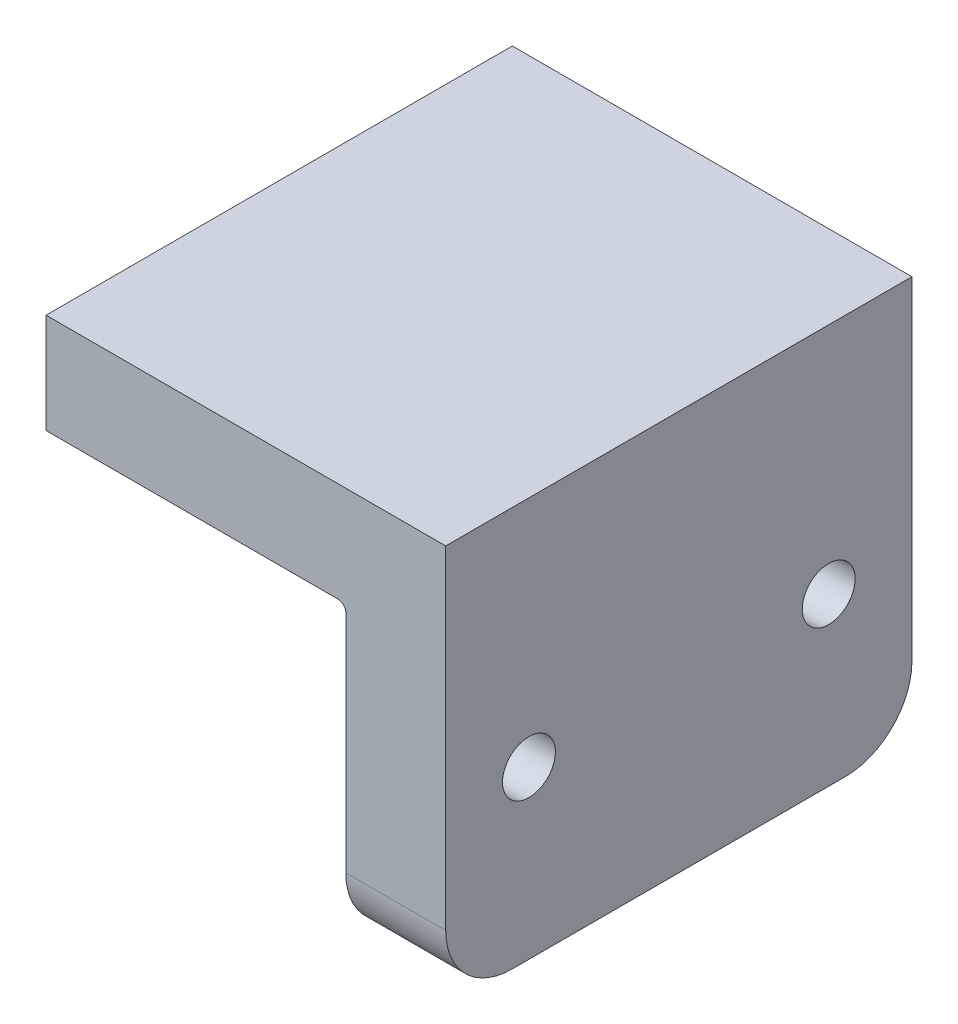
SolidWorks part; units mm, degrees
ref_plane "Front Plane" through (0, 0, 0) normal (0, 0, 1) x (1, 0, 0)
ref_plane "Top Plane" through (0, 0, 0) normal (0, 1, 0) x (1, 0, 0)
ref_plane "Right Plane" through (0, 0, 0) normal (1, 0, 0) x (0, 0, -1)
sketch "Sketch1" plane through (0, 0, 0) normal (0, 0, 1) x (1, 0, 0)
  line L2 (-76.2, 0) -> (-76.2, -19.05)
  line L3 (-76.2, -19.05) -> (-19.05, -19.05)
  line L5 (0, 0) -> (-76.2, 0)
  line L6 (0, 0) -> (0, -76.2)
  line L7 (0, -76.2) -> (-19.05, -76.2)
  line L8 (-19.05, -19.05) -> (-19.05, -76.2)
  dimension "D1" = 76.2
  dimension "D2" = 76.2
  dimension "D3" = 19.05
extrude "Extrude1" add sketch "Sketch1" along normal mid plane 88.9
fillet "Fillet1" radius 1.524 1 edges at (-19.05, -19.05, 0)
hole_wizard "CBORE for 3/8 Socket Head Cap Screw1" positions "Sketch3" profile "Sketch2" counterbore size "3/8" standard "Ansi Inch"
sketch "Sketch3" plane through (-19.05, 0, 0) normal (-1, 0, 0) x (0, 0, 1)
  line L0 (0, -76.2) -> (0, -38.9537) construction
  line L1 (44.45, -76.2) -> (-44.45, -76.2) construction
  line L2 (-44.45, -20.574) -> (-44.45, -76.2) construction
  point P0 (-28.575, -44.45)
  point P8 (28.575, -44.45)
  dimension "D1" = 15.875
  dimension "D2" = 31.75
sketch "Sketch2" plane through (-19.05, -44.45, -28.575) normal (0, 1, 0) x (0, 0, 1)
  line L0 (0, 0) -> (0, 19.05)
  line L1 (0, 19.05) -> (5.0419, 19.05)
  line L3 (5.0419, 19.05) -> (5.0419, 9.525)
  line L4 (5.0419, 9.525) -> (7.9375, 9.525)
  line L5 (7.9375, 9.525) -> (7.9375, 0)
  line L7 (7.9375, 0) -> (0, 0)
  line L11 (0, -6.35) -> (0, 107.95) construction
  dimension "Thru Hole Dia." = 10.0838
  dimension "Thru Hole Depth" = 19.05
  dimension "C'Bore Dia." = 15.875
  dimension "C'Bore Depth" = 9.525
fillet "Fillet2" radius 12.7 2 edges at (-9.525, -76.2, -44.45) (-9.525, -76.2, 44.45)
fillet "Fillet4" [suppressed] radius 0.762
sketch "Sketch4" plane through (0, -76.2, 0) normal (0, -1, 0) x (1, 0, 0)
  line L0 (-9.1712, -29.9329) -> (-9.1712, 15.4151) construction
  text T0 "<b>PART NUMBER 12345  MADE IN THE USA</b>" font "Century Gothic" height in points 10
extrude "Cut-Extrude1" cut sketch "Sketch4" against normal blind 0.762
fillet "Fillet5" [suppressed] radius 1.524
fillet "Fillet6" [suppressed] radius 1.524
sketch "Sketch5" plane through (0, -76.2, 0) normal (0, -1, 0) x (1, 0, 0)
  line L1 (-13.6835, -30.644) -> (-2.4347, -30.644)
  line L2 (-13.6835, -30.644) -> (-13.6835, 7.1171)
  line L3 (-13.6835, 7.1171) -> (-2.4347, 7.1171)
  line L4 (-2.4347, -30.644) -> (-2.4347, 7.1171)
extrude "Extrude2" add sketch "Sketch5" against normal blind 9.906
